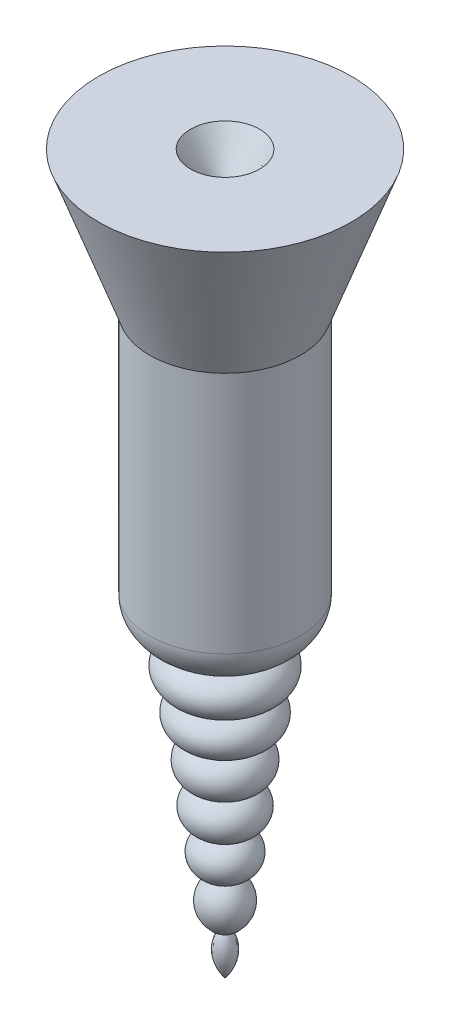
SolidWorks part; units mm, degrees
ref_plane "Front Plane" through (0, 0, 0) normal (0, 0, 1) x (1, 0, 0)
ref_plane "Top Plane" through (0, 0, 0) normal (0, 1, 0) x (1, 0, 0)
ref_plane "Right Plane" through (0, 0, 0) normal (1, 0, 0) x (0, 0, -1)
sketch "Sketch2" plane through (0, 0, 0) normal (0, 0, 1) x (1, 0, 0)
  line L0 (0, 0) -> (0, -11.8094)
  line L1 (0, -11.8094) -> (0.508, -11.8094) construction
  line L2 (1.3321, -1.6025) -> (1.3321, -1.6061)
  line L11 (1.3321, -1.6025) -> (2.2352, 0.8906)
  line L12 (0.6117, 0.8906) -> (0, 0)
  line L16 (0.6117, 0.8906) -> (2.2352, 0.8906)
  line L18 (1.3321, -1.6061) -> (1.3321, -5.9032)
  ellipse E1 centre (0.0233, -9.8713) end of major axis (0.5019, -9.8715) minor radius 0.3908 (0.2024, -10.2337) -> (0.2569, -9.5302) ccw
  ellipse E4 centre (0.1577, -9.1645) end of major axis (0.6037, -9.1647) minor radius 0.3751 (0.2569, -9.5302) -> (0.3394, -8.822) ccw
  ellipse E5 centre (0.2743, -8.4597) end of major axis (0.6757, -8.4599) minor radius 0.3672 (0.3394, -8.822) -> (0.3617, -8.1014) ccw
  ellipse E6 centre (0.4847, -7.0179) end of major axis (0.0166, -7.0177) minor radius 0.3745 (0.5069, -7.392) -> (0.5557, -6.6477) ccw
  ellipse E8 centre (0.3623, -7.7372) end of major axis (-0.0929, -7.737) minor radius 0.3642 (0.3617, -8.1014) -> (0.5069, -7.392) ccw
  ellipse E10 centre (0.3872, -5.9039) end of major axis (-0.5577, -5.9057) minor radius 0.756 (0.5557, -6.6477) -> (1.3321, -5.9032) ccw
  ellipse E13 centre (-2.0395, -11.4937) end of major axis (0.1698, -11.3238) minor radius 1.1174 (0, -11.8094) -> (0.0946, -11.0787) ccw
  ellipse E15 centre (-0.2961, -10.6195) end of major axis (-0.9883, -10.6192) minor radius 0.5562 (0.0946, -11.0787) -> (0.2024, -10.2337) ccw
  point P1 (0, 0)
  dimension "D1" = 12.7
  dimension "D2" = 2.2352
  dimension "D3" = 0.508
revolve "Revolve1" add sketch "Sketch2" angle 360 about L0
